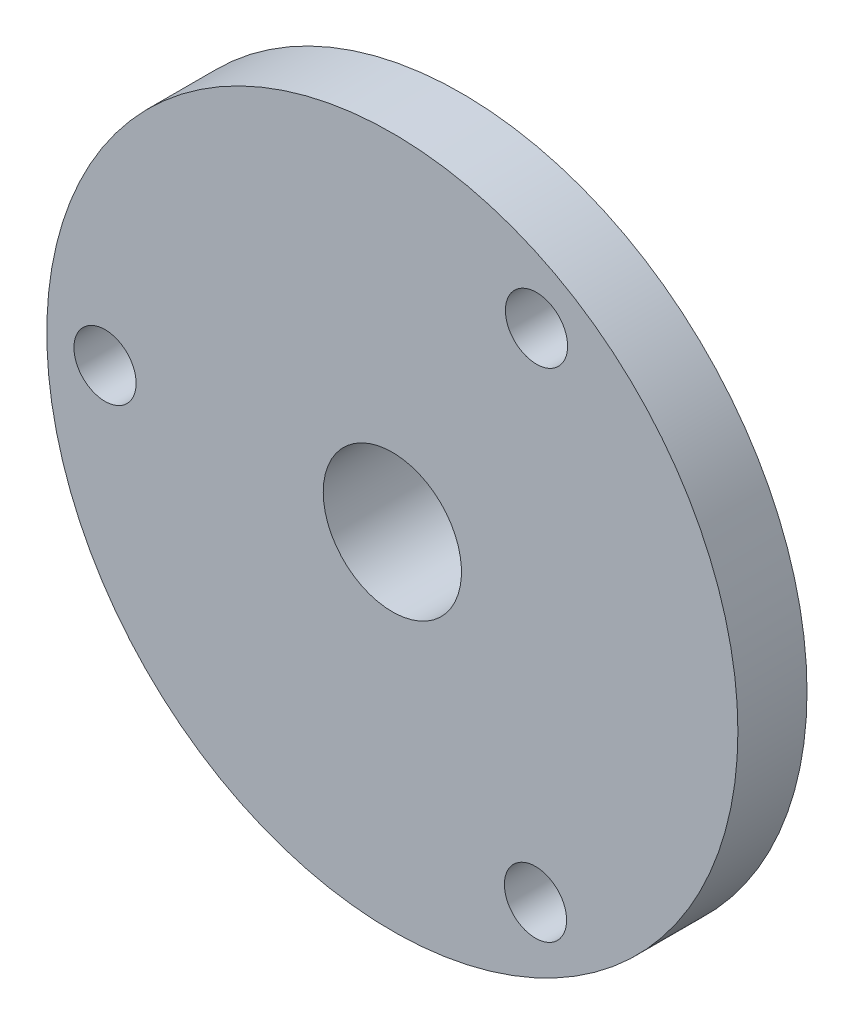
SolidWorks part; units mm, degrees
ref_plane "Спереди" through (0, 0, 0) normal (0, 0, 1) x (1, 0, 0)
ref_plane "Сверху" through (0, 0, 0) normal (0, 1, 0) x (1, 0, 0)
ref_plane "Справа" through (0, 0, 0) normal (1, 0, 0) x (0, 0, -1)
sketch "Sketch1" plane through (0, 0, 0) normal (0, 0, 1) x (1, 0, 0)
  circle A0 centre (0, 0) radius 50
extrude "Boss-Extrude1" add sketch "Sketch1" along normal blind 10 contours A0
sketch "Sketch2" plane through (0, 0, 0) normal (0, 0, -1) x (-1, 0, 0)
  circle A0 centre (41.5691, 0.0827) radius 4.5
  circle A4 centre (-20.8562, 35.9586) radius 4.5
  circle A5 centre (-20.7129, -36.0413) radius 4.5
extrude "Cut-Extrude2" cut sketch "Sketch2" against normal blind 10
sketch "Sketch4" plane through (0, 0, 0) normal (0, 0, -1) x (-1, 0, 0)
  circle A0 centre (0, 0) radius 15
extrude "Boss-Extrude2" add sketch "Sketch4" along normal blind 10
sketch "Sketch5" plane through (0, 0, -10) normal (0, 0, -1) x (-1, 0, 0)
  circle A0 centre (0, 0) radius 10
extrude "Cut-Extrude3" cut sketch "Sketch5" against normal blind 20
sketch3d "Sketch_MAC1-1_ПОСАДОЧНЫЙ_ДЛЯ_БАБКИ_MILLING" [suppressed]
  line L0 (-50, 49.9901, -10) -> (-40, 49.9901, -10)
  line L1 (-50, 49.9901, -10) -> (-50, 39.9901, -10)
  point P0 (-50, 49.9901, -10)
  point P1 (-40, 49.9901, -10)
  point P2 (-50, 39.9901, -10)
